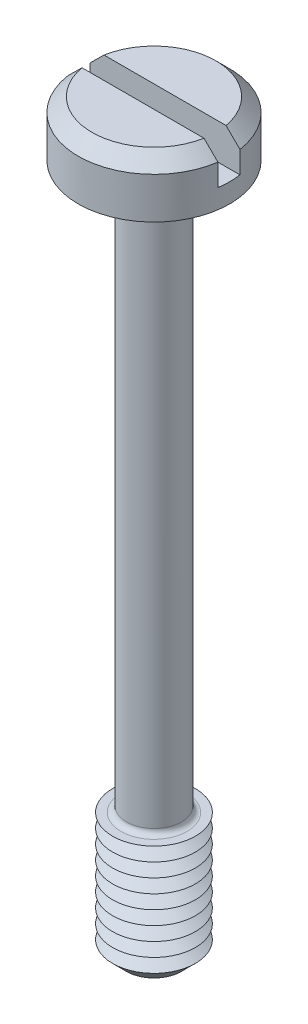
SolidWorks part; units mm, degrees
ref_plane "Front Plane" through (0, 0, 0) normal (0, 0, 1) x (1, 0, 0)
ref_plane "Top Plane" through (0, 0, 0) normal (0, 1, 0) x (1, 0, 0)
ref_plane "Right Plane" through (0, 0, 0) normal (1, 0, 0) x (0, 0, -1)
sketch "Sketch1" plane through (0, 0, 0) normal (0, 1, 0) x (1, 0, 0)
  circle A0 centre (0, 0) radius 2.75
  dimension "D1" = 5.5
extrude "Boss-Extrude1" add sketch "Sketch1" along normal blind 2
sketch "Sketch2" plane through (0, 0, 0) normal (0, -1, 0) x (1, 0, 0)
  circle A0 centre (0, 0) radius 1
  dimension "D1" = 2
extrude "Boss-Extrude2" add sketch "Sketch2" along normal blind 25
sketch "Sketch3" plane through (0, -25, 0) normal (0, -1, 0) x (1, 0, 0)
  circle A0 centre (0, 0) radius 1.5
  dimension "D1" = 3
extrude "Boss-Extrude3" add sketch "Sketch3" against normal blind 4.5
chamfer "Chamfer1" distance 0.5 angle 45 1 edges at (0, -25, -1.5)
sketch "Sketch4" plane through (0, 0, 0) normal (1, 0, 0) x (0, 0, -1)
  line L0 (0, -6.5871) -> (0, -12.0372) construction
sketch "Sketch5" plane through (0, 0, 0) normal (1, 0, 0) x (0, 0, -1)
  line L0 (-1.5, -20.5) -> (-1.067, -20.75)
  line L1 (-1.067, -20.75) -> (-1.5, -21)
  line L2 (-1.5, -20.5) -> (-1.5, -24.5) construction
  line L3 (-1.5, -21) -> (-1.5, -20.5)
  dimension "D1" = 0.5
revolve "Cut-Revolve1" cut sketch "Sketch5" angle 360 about L0
pattern_linear "LPattern1" count 8 spacing 0.5 along (0, -1, 0) of "Cut-Revolve1"
fillet "Fillet1" radius 0.2 2 edges at (0, -20.5, -1) (0, 0, -1)
chamfer "Chamfer2" distance 0.5 angle 45 1 edges at (0, 2, 2.75)
sketch "Sketch6" plane through (0, 2, 0) normal (0, 1, 0) x (1, 0, 0)
  line L1 (2.75, -0.4) -> (-2.75, -0.4)
  line L2 (2.75, -0.4) -> (2.75, 0.4)
  line L3 (2.75, 0.4) -> (-2.75, 0.4)
  line L4 (-2.75, -0.4) -> (-2.75, 0.4)
  line L5 (2.75, -0.4) -> (-2.75, 0.4) construction
  line L6 (2.75, 0.4) -> (-2.75, -0.4) construction
  circle A0 centre (0, 0) radius 2.75 construction
  point P0 (0, 0)
  dimension "D1" = 0.8
extrude "Cut-Extrude1" cut sketch "Sketch6" against normal blind 1.3
